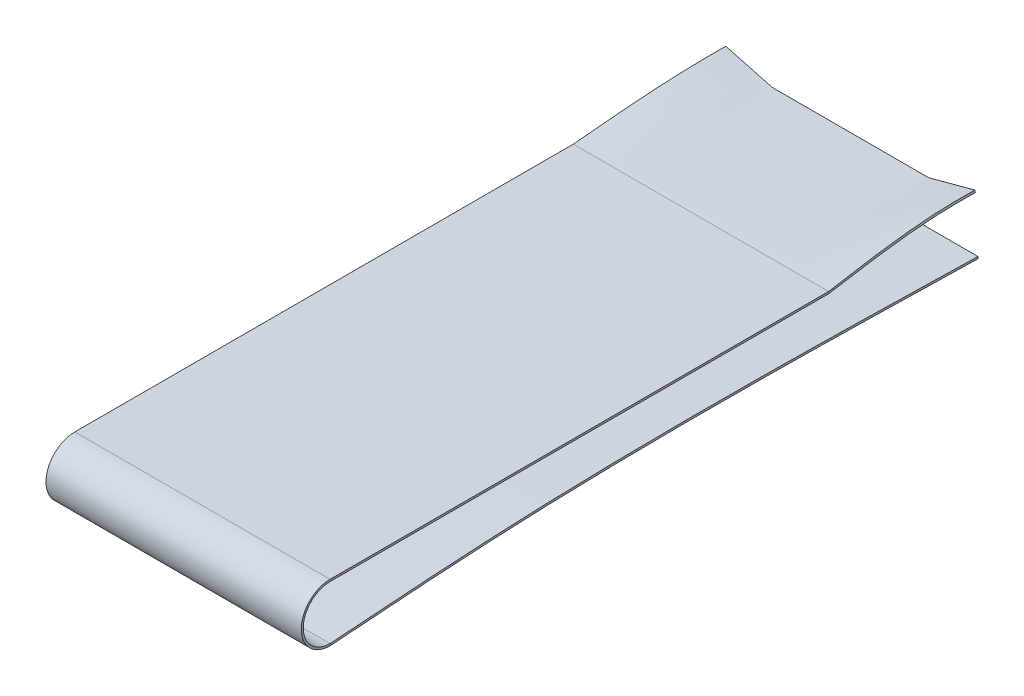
SolidWorks part; units mm, degrees
ref_plane "Plan de face" through (0, 0, 0) normal (0, 0, 1) x (1, 0, 0)
ref_plane "Plan de dessus" through (0, 0, 0) normal (0, 1, 0) x (1, 0, 0)
ref_plane "Plan de droite" through (0, 0, 0) normal (1, 0, 0) x (0, 0, -1)
sketch "Esquisse1" plane through (0, 0, 0) normal (0, 0, 1) x (1, 0, 0)
  line L1 (-640, 35.3244) -> (640, 35.3244)
  line L2 (-640, 35.3244) -> (-640, 25.3244)
  line L3 (-640, 25.3244) -> (640, 25.3244)
  line L4 (640, 35.3244) -> (640, 25.3244)
  dimension "D1" = 1280
  dimension "D2" = 10
  dimension "D3" = 640
extrude "Extrusion1" add sketch "Esquisse1" along normal blind 2500
sketch "Esquisse2" plane through (0, 0, 2500) normal (0, 0, 1) x (1, 0, 0)
  line L2 (-119.056, -109.1756) -> (1268.8305, -109.1756) construction
  line L4 (-640, 35.3244) -> (-640, 25.3244)
  line L5 (-640, 25.3244) -> (640, 25.3244)
  line L6 (640, 25.3244) -> (640, 35.3244)
  line L7 (640, 35.3244) -> (-640, 35.3244)
  line L8 (-640, 35.3244) -> (-640, 25.3244)
  line L9 (-640, 25.3244) -> (640, 25.3244)
  line L10 (640, 25.3244) -> (640, 35.3244)
  line L11 (640, 35.3244) -> (-640, 35.3244)
  dimension "D2" = 134.5
  dimension "D1" = 0
revolve "Révolution1" add sketch "Esquisse2" angle 180 about L2
sketch "Esquisse3" plane through (0, 0, 0) normal (0, 0, -1) x (-1, 0, 0)
  line L4 (640, 25.3244) -> (640, 35.3244)
  line L5 (640, 35.3244) -> (-640, 35.3244)
  line L6 (-640, 35.3244) -> (-640, 25.3244)
  line L7 (-640, 25.3244) -> (640, 25.3244)
  line L8 (640, 25.3244) -> (640, 35.3244)
  line L9 (640, 35.3244) -> (-640, 35.3244)
  line L10 (-640, 35.3244) -> (-640, 25.3244)
  line L11 (-640, 25.3244) -> (640, 25.3244)
  dimension "D1" = 0
ref_plane "Plan1" through (0, 0, -624) normal (0, 0, -1) x (-1, 0, 0)
sketch "Esquisse4" plane through (0, 0, -624) normal (0, 0, -1) x (-1, 0, 0)
  line L0 (-627.0034, 83.8282) -> (-400.0945, 23.0281)
  line L1 (-624.4153, 93.4874) -> (-398.7779, 33.0281)
  line L2 (626.9633, 83.9782) -> (399.4945, 23.0281)
  line L3 (-385.837, 31.3244) -> (385.237, 31.3244)
  line L4 (-387.1535, 21.3244) -> (386.5535, 21.3244)
  line L5 (686.8467, 100.0239) -> (406.7282, 24.9664) construction
  line L6 (624.3751, 93.6374) -> (398.1779, 33.0281)
  line L7 (-407.3282, 24.9664) -> (-687.4467, 100.0239) construction
  line L8 (-627.0034, 83.8282) -> (-624.4153, 93.4874)
  line L9 (626.9633, 83.9782) -> (624.3751, 93.6374)
  line L10 (-393.7361, 21.3244) -> (393.1361, 21.3244) construction
  line L11 (-627.0034, 83.8282) -> (-393.7361, 21.3244) construction
  line L12 (-392.4196, 31.3244) -> (391.8196, 31.3244) construction
  line L13 (-624.4153, 93.4874) -> (-392.4196, 31.3244) construction
  line L14 (626.9633, 83.9782) -> (393.1361, 21.3244) construction
  line L15 (624.3751, 93.6374) -> (391.8196, 31.3244) construction
  arc A0 (-387.1535, 21.3244) -> (-400.0945, 23.0281) centre (-387.1535, 71.3244) cw
  arc A1 (-385.837, 31.3244) -> (-398.7779, 33.0281) centre (-385.837, 81.3244) cw
  arc A2 (399.4945, 23.0281) -> (386.5535, 21.3244) centre (386.5535, 71.3244) cw
  arc A3 (398.1779, 33.0281) -> (385.237, 31.3244) centre (385.237, 81.3244) cw
  dimension "D1" = 10
  dimension "D2" = 50
  dimension "D3" = 50
sketch "Esquisse5" plane through (0, 0, 2500) normal (0, 0, -1) x (-1, 0, 0)
  line L4 (-640, -253.6756) -> (640, -253.6756)
  line L5 (640, -253.6756) -> (640, -243.6756)
  line L6 (640, -243.6756) -> (-640, -243.6756)
  line L7 (-640, -243.6756) -> (-640, -253.6756)
  line L8 (-640, -253.6756) -> (640, -253.6756)
  line L9 (640, -253.6756) -> (640, -243.6756)
  line L10 (640, -243.6756) -> (-640, -243.6756)
  line L11 (-640, -243.6756) -> (-640, -253.6756)
  dimension "D1" = 0
ref_plane "Plan3" through (0, 0, -749) normal (0, 0, -1) x (-1, 0, 0)
sketch "Esquisse8" plane through (0, 0, -749) normal (0, 0, -1) x (-1, 0, 0)
  line L8 (385.237, 31.3244) -> (-385.837, 31.3244)
  line L9 (624.3751, 93.6374) -> (398.1779, 33.0281)
  line L10 (626.9633, 83.9782) -> (624.3751, 93.6374)
  line L11 (399.4945, 23.0281) -> (626.9633, 83.9782)
  line L12 (-387.1535, 21.3244) -> (386.5535, 21.3244)
  line L13 (-627.0034, 83.8282) -> (-400.0945, 23.0281)
  line L14 (-624.4153, 93.4874) -> (-627.0034, 83.8282)
  line L15 (-398.7779, 33.0281) -> (-624.4153, 93.4874)
  line L16 (385.237, 31.3244) -> (-385.837, 31.3244)
  line L17 (624.3751, 93.6374) -> (398.1779, 33.0281)
  line L18 (626.9633, 83.9782) -> (624.3751, 93.6374)
  line L19 (399.4945, 23.0281) -> (626.9633, 83.9782)
  line L20 (-387.1535, 21.3244) -> (386.5535, 21.3244)
  line L21 (-627.0034, 83.8282) -> (-400.0945, 23.0281)
  line L22 (-624.4153, 93.4874) -> (-627.0034, 83.8282)
  line L23 (-398.7779, 33.0281) -> (-624.4153, 93.4874)
  arc A4 (-398.7779, 33.0281) -> (-385.837, 31.3244) centre (-385.837, 81.3244) ccw
  arc A5 (385.237, 31.3244) -> (398.1779, 33.0281) centre (385.237, 81.3244) ccw
  arc A6 (386.5535, 21.3244) -> (399.4945, 23.0281) centre (386.5535, 71.3244) ccw
  arc A7 (-400.0945, 23.0281) -> (-387.1535, 21.3244) centre (-387.1535, 71.3244) ccw
  arc A8 (-398.7779, 33.0281) -> (-385.837, 31.3244) centre (-385.837, 81.3244) ccw
  arc A9 (385.237, 31.3244) -> (398.1779, 33.0281) centre (385.237, 81.3244) ccw
  arc A10 (386.5535, 21.3244) -> (399.4945, 23.0281) centre (386.5535, 71.3244) ccw
  arc A11 (-400.0945, 23.0281) -> (-387.1535, 21.3244) centre (-387.1535, 71.3244) ccw
  dimension "D1" = 0
surface "Surface-Lissage6"
ref_plane "Plan2" through (0, 0, 1626.5) normal (0, 0, -1) x (-1, 0, 0)
sketch "Esquisse7" plane through (0, 0, 1626.5) normal (0, 0, -1) x (-1, 0, 0)
  line L1 (640, -197.1681) -> (-640.1651, -197.1681)
  line L6 (-600.6597, -197.1681) -> (-604.9403, -197.1681) construction
  line L7 (640, -243.6756) -> (640, 25.3244) construction
  line L8 (-640.1651, -197.1681) -> (-640, -187.1695)
  line L9 (-640, 25.3244) -> (-640, -243.6756) construction
  line L10 (-640, -187.1695) -> (640, -187.1695)
  line L11 (640, -187.1695) -> (640, -197.1681)
  dimension "D1" = 10
sketch "Esquisse11" plane through (0, 0, -749) normal (0, 0, -1) x (-1, 0, 0)
  line L4 (-640.1651, -197.1681) -> (640, -197.1681)
  line L5 (-640, -187.1695) -> (-640.1651, -197.1681)
  line L6 (640, -187.1695) -> (-640, -187.1695)
  line L7 (640, -197.1681) -> (640, -187.1695)
  line L8 (-640.1651, -197.1681) -> (640, -197.1681)
  line L9 (-640, -187.1695) -> (-640.1651, -197.1681)
  line L10 (640, -187.1695) -> (-640, -187.1695)
  line L11 (640, -197.1681) -> (640, -187.1695)
  dimension "D1" = 0
surface "Surface-Lissage7" parameters "D4"=10
